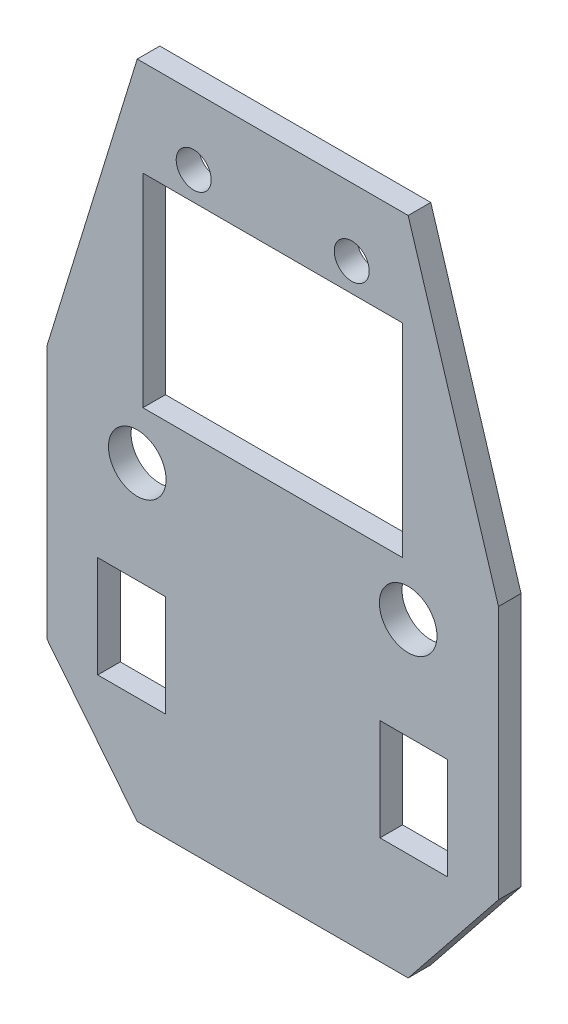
SolidWorks part; units mm, degrees
ref_plane "前视基准面" through (0, 0, 0) normal (0, 0, 1) x (1, 0, 0)
ref_plane "上视基准面" through (0, 0, 0) normal (0, 1, 0) x (1, 0, 0)
ref_plane "右视基准面" through (0, 0, 0) normal (1, 0, 0) x (0, 0, -1)
other "Configuration Table"
sketch "草图1" plane through (0, 0, 0) normal (0, 0, 1) x (1, 0, 0)
  line L0 (-40, -35) -> (-24, -55)
  line L1 (-24, -55) -> (24, -55)
  line L2 (24, -55) -> (40, -35)
  line L3 (40, -35) -> (40, 10)
  line L4 (40, 10) -> (24, 62)
  line L5 (24, 62) -> (-24, 62)
  line L6 (-24, 62) -> (-40, 10)
  line L7 (-40, 10) -> (-40, -35)
  dimension "D1" = 24
  dimension "D2" = 40
  dimension "D3" = 24
  dimension "D4" = 10
  dimension "D5" = 62
  dimension "D6" = 35
  dimension "D7" = 55
extrude "Palm_Frame" add sketch "草图1" against normal mid plane 4
sketch "草图2" plane through (0, 0, 0) normal (0, 0, 1) x (1, 0, 0)
  circle A0 centre (-24, 0) radius 5.1
  circle A1 centre (24, 0) radius 5.1
  circle A2 centre (-14, 50) radius 3.1
  circle A3 centre (14, 50) radius 3.1
  dimension "D1" = 10.2
  dimension "D2" = 6.2
  dimension "D3" = 14
  dimension "D4" = 24
  dimension "D5" = 14
  dimension "D6" = 24
  dimension "D7" = 50
extrude "Ground_Pivot_Bores" cut sketch "草图2" against normal mid plane 500
sketch "草图3" plane through (0, 0, 0) normal (0, 0, 1) x (1, 0, 0)
  line L1 (-23, 9) -> (23, 9)
  line L2 (-23, 9) -> (-23, 45)
  line L3 (-23, 45) -> (23, 45)
  line L4 (23, 9) -> (23, 45)
  line L5 (-23, 9) -> (23, 45) construction
  line L6 (-23, 45) -> (23, 9) construction
  line L7 (-31, -36) -> (-19, -36)
  line L8 (-31, -36) -> (-31, -18)
  line L9 (-31, -18) -> (-19, -18)
  line L10 (-19, -36) -> (-19, -18)
  line L11 (-31, -36) -> (-19, -18) construction
  line L12 (-31, -18) -> (-19, -36) construction
  line L13 (19, -36) -> (31, -36)
  line L14 (19, -36) -> (19, -18)
  line L15 (19, -18) -> (31, -18)
  line L16 (31, -36) -> (31, -18)
  line L17 (19, -36) -> (31, -18) construction
  line L18 (19, -18) -> (31, -36) construction
  point P0 (0, 27)
  point P5 (-25, -27)
  point P10 (25, -27)
  dimension "D1" = 19
  dimension "D2" = 23
  dimension "D3" = 25
  dimension "D4" = 9
  dimension "D5" = 27
  dimension "D6" = 18
extrude "Linkage_Inspection_Windows" cut sketch "草图3" against normal mid plane 500
